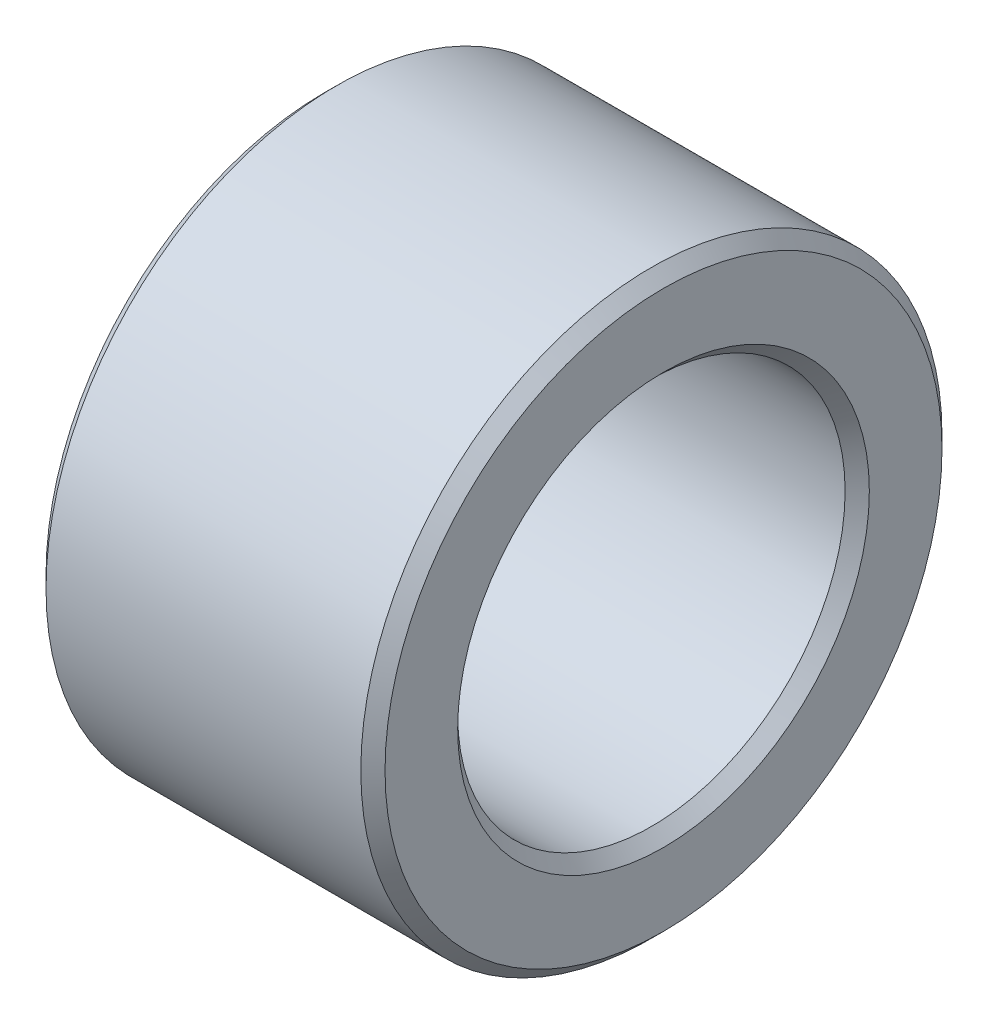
SolidWorks part; units mm, degrees
ref_plane "Front Plane" through (0, 0, 0) normal (0, 0, 1) x (1, 0, 0)
ref_plane "Top Plane" through (0, 0, 0) normal (0, 1, 0) x (1, 0, 0)
ref_plane "Right Plane" through (0, 0, 0) normal (1, 0, 0) x (0, 0, -1)
sketch "Sketch1" plane through (0, 0, 0) normal (1, 0, 0) x (0, 0, -1)
  circle A0 centre (0, 0) radius 6
  circle A1 centre (0, 0) radius 4
  dimension "D1" = 12
  dimension "D2" = 8
extrude "Extrude1" add sketch "Sketch1" along normal blind 7
chamfer "Chamfer1" distance 0.25 angle 45 4 edges at (0, 0, -4) (7, 0, -4) (0, 0, -6) (7, 0, -6)
